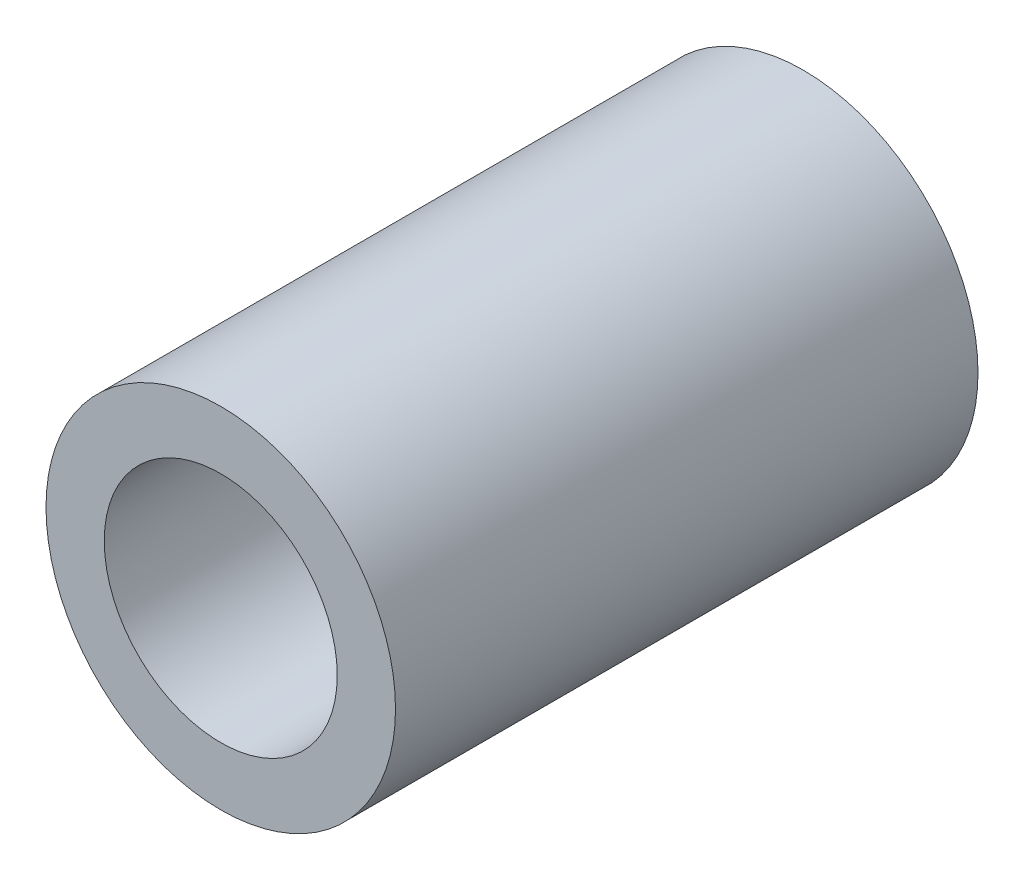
SolidWorks part; units mm, degrees
ref_plane "Face" through (0, 0, 0) normal (0, 0, 1) x (1, 0, 0)
ref_plane "Dessus" through (0, 0, 0) normal (0, 1, 0) x (1, 0, 0)
ref_plane "Droite" through (0, 0, 0) normal (1, 0, 0) x (0, 0, -1)
sketch "Esquisse1" plane through (0, 0, 0) normal (0, 0, 1) x (1, 0, 0)
  line L0 (-100.8436, 0) -> (117.4252, 0) construction
  line L1 (0, 87.3075) -> (0, -85.6155) construction
  circle A0 centre (0, 0) radius 30
  dimension "D1" = 60
extrude "Extrusion1" add sketch "Esquisse1" along normal blind 100
sketch "Esquisse2" plane through (0, 0, 0) normal (0, 0, 1) x (1, 0, 0)
  circle A0 centre (0, 0) radius 20
  circle A3 centre (0, 0) radius 30 construction
  dimension "D1" = 40
extrude "Enlèv. mat.-Extru.2" cut sketch "Esquisse2" along normal through all
sketch "Esquisse3" plane through (0, 0, 100) normal (0, 0, 1) x (1, 0, 0)
  line L0 (0, 40) -> (0, -40)
  line L1 (0, 40) -> (40, 40)
  line L2 (40, 40) -> (40, -40)
  line L3 (40, -40) -> (0, -40)
  dimension "D1" = 40
  dimension "D2" = 80
  dimension "D3" = 40
extrude "Enlèv. mat.-Extru.3" cut sketch "Esquisse3" against normal through all
